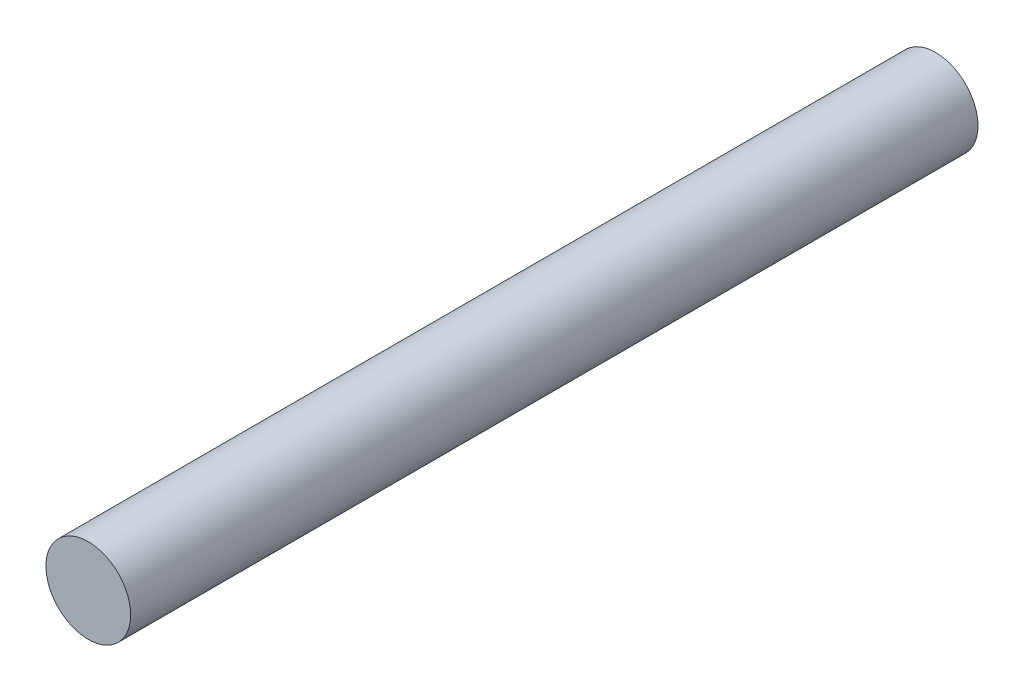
SolidWorks part; units mm, degrees
ref_plane "前视基准面" through (0, 0, 0) normal (0, 0, 1) x (1, 0, 0)
ref_plane "上视基准面" through (0, 0, 0) normal (0, 1, 0) x (1, 0, 0)
ref_plane "右视基准面" through (0, 0, 0) normal (1, 0, 0) x (0, 0, -1)
sketch "草图1" plane through (0, 0, 0) normal (0, 0, 1) x (1, 0, 0)
  circle A0 centre (36.1191, -58.1968) radius 2.5
  dimension "D1" = 5
extrude "凸台-拉伸1" add sketch "草图1" along normal blind 50 contours A0
